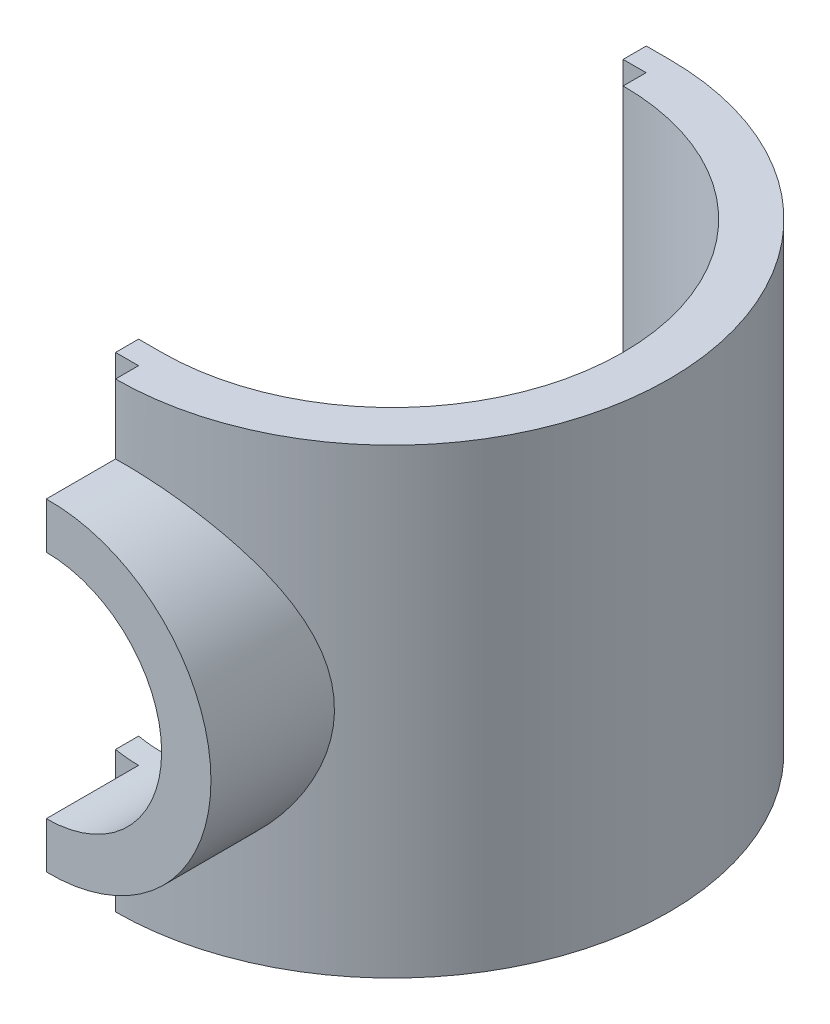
SolidWorks part; units mm, degrees
ref_plane "Front Plane" through (0, 0, 0) normal (0, 0, 1) x (1, 0, 0)
ref_plane "Top Plane" through (0, 0, 0) normal (0, 1, 0) x (1, 0, 0)
ref_plane "Right Plane" through (0, 0, 0) normal (1, 0, 0) x (0, 0, -1)
sketch "Sketch1" plane through (0, 0, 0) normal (0, 1, 0) x (1, 0, 0)
  line L0 (0, 0) -> (0, 16.9714) construction
  line L1 (0, 10) -> (0, 12)
  line L2 (0, -10) -> (0, -12)
  circle A0 centre (0, 0) radius 10 construction
  circle A1 centre (0, 0) radius 12 construction
  arc A2 (0, -10) -> (0, 10) centre (0, 0) ccw
  arc A3 (0, -12) -> (0, 12) centre (0, 0) ccw
extrude "Boss-Extrude1" add sketch "Sketch1" along normal blind 20
ref_plane "Plane1" through (0, 0, 12) normal (0, 0, 1) x (1, 0, 0)
sketch "Sketch3" plane through (0, 0, 12) normal (0, 0, 1) x (1, 0, 0)
  line L0 (0, 20) -> (0, 0) construction
  line L1 (0, 16.9986) -> (0, 15)
  line L2 (0, 5) -> (0, 3.0014)
  circle A0 centre (0, 10) radius 5 construction
  circle A1 centre (0.1376, 10) radius 7 construction
  arc A2 (0, 16.9986) -> (0, 3.0014) centre (0.1376, 10) cw
  arc A3 (0, 5) -> (0, 15) centre (0, 10) ccw
extrude "Boss-Extrude2" add sketch "Sketch3" along normal blind 3 and the other way up to surface
sketch "Sketch5" plane through (0, 0, 0) normal (0, 1, 0) x (1, 0, 0)
  line L1 (0, 12) -> (-0.9973, 12)
  line L2 (0, 12) -> (0, 10.9951)
  line L3 (0, 10.9951) -> (-0.9973, 10.9951)
  line L4 (-0.9973, 12) -> (-0.9973, 10.9951)
  line L5 (0, -10) -> (-0.9973, -10)
  line L6 (0, -10) -> (0, -10.9996)
  line L7 (0, -10.9996) -> (-0.9973, -10.9996)
  line L8 (-0.9973, -10) -> (-0.9973, -10.9996)
extrude "Boss-Extrude3" add sketch "Sketch5" along normal up to surface (20 mm away)
sketch "Sketch4" plane through (0, 0, 12) normal (0, 0, 1) x (1, 0, 0)
  circle A2 centre (0, 10) radius 5
extrude "Cut-Extrude1" cut sketch "Sketch4" against normal blind 13
